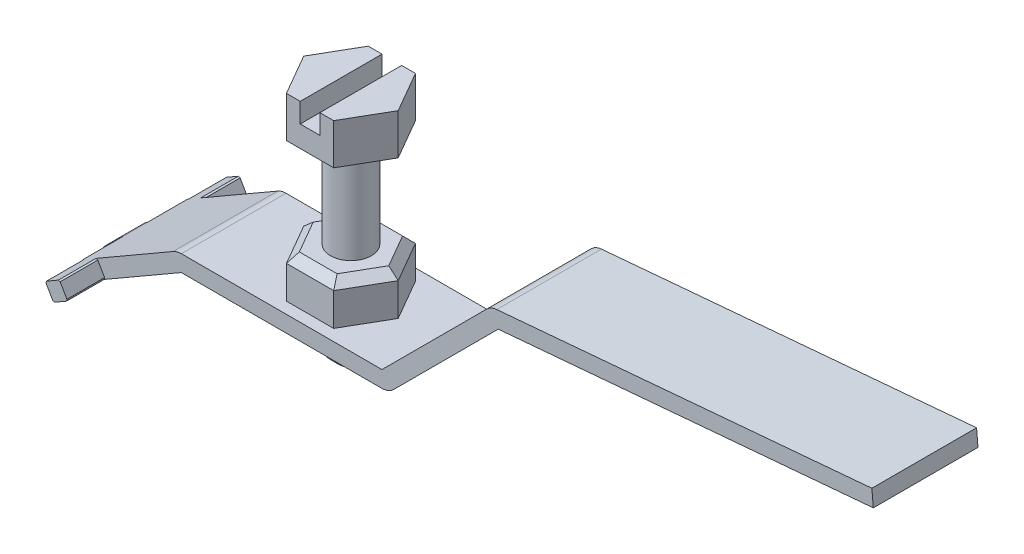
SolidWorks part; units mm, degrees
ref_plane "Plan de face" through (0, 0, 0) normal (0, 0, 1) x (1, 0, 0)
ref_plane "Plan de dessus" through (0, 0, 0) normal (0, 1, 0) x (1, 0, 0)
ref_plane "Plan de droite" through (0, 0, 0) normal (1, 0, 0) x (0, 0, -1)
sketch "Esquisse1" plane through (0, 0, 0) normal (0, 0, 1) x (1, 0, 0)
  line L0 (0, 0) -> (5.1962, 3) construction
  line L1 (5.1962, 3) -> (17.8038, 3) construction
  line L2 (17.8038, 3) -> (24.4737, 9.6698) construction
  line L3 (24.4737, 9.6698) -> (47.5847, 11.6918) construction
  line L4 (11.5, 3) -> (11.5, -11.7532) construction
  line L5 (0.25, -0.433) -> (5.3301, 2.5)
  line L6 (5.3301, 2.5) -> (17.5967, 2.5)
  line L7 (18.3038, 2.7929) -> (24.6985, 9.1876)
  line L8 (24.6985, 9.1876) -> (47.6283, 11.1937)
  line L9 (-0.25, 0.433) -> (4.8301, 3.366)
  line L10 (5.3301, 3.5) -> (17.5967, 3.5)
  line L11 (17.5967, 3.5) -> (23.9914, 9.8947)
  line L12 (24.6114, 10.1838) -> (47.5411, 12.1899)
  line L13 (47.5411, 12.1899) -> (47.6283, 11.1937)
  line L14 (17.5967, 3.5) -> (24.2488, 10.1521) construction
  line L15 (24.2488, 10.1521) -> (47.5411, 12.1899) construction
  line L16 (5.3301, 2.5) -> (18.011, 2.5) construction
  line L17 (18.011, 2.5) -> (24.6985, 9.1876) construction
  line L18 (-0.25, 0.433) -> (5.0622, 3.5) construction
  line L19 (5.0622, 3.5) -> (17.5967, 3.5) construction
  line L20 (-0.25, 0.433) -> (-0.683, 0.183)
  line L21 (-0.683, 0.183) -> (-0.183, -0.683)
  line L22 (-0.183, -0.683) -> (0.25, -0.433)
  circle A0 centre (0, 0) radius 49 construction
  arc A1 (23.9914, 9.8947) -> (24.6114, 10.1838) centre (24.6985, 9.1876) cw
  arc A2 (17.5967, 2.5) -> (18.3038, 2.7929) centre (17.5967, 3.5) ccw
  arc A3 (4.8301, 3.366) -> (5.3301, 3.5) centre (5.3301, 2.5) cw
  circle A4 centre (0, 0) radius 0.5 construction
  dimension "D1" = 98
  dimension "D10" = 1
  dimension "D2" = 7.5
  dimension "D3" = 135
  dimension "D4" = 150
  dimension "D5" = 140
  dimension "D6" = 11.5
  dimension "D7" = 3
  dimension "D8" = 0.5
  dimension "D9" = 0.5
extrude "Boss.-Extru.1" add sketch "Esquisse1" along normal mid plane 6.4
sketch "Esquisse2" plane through (0, 0, 0) normal (0, 0, 1) x (1, 0, 0)
  line L0 (-0.683, 0.183) -> (-0.183, -0.683) construction
  line L1 (4.8301, 3.366) -> (-0.683, 0.183) construction
  line L2 (-0.183, -0.683) -> (5.3301, 2.5) construction
  line L3 (-0.683, 0.183) -> (-0.183, -0.683)
  line L4 (0.183, 0.683) -> (-0.683, 0.183)
  line L5 (-0.183, -0.683) -> (0.683, -0.183)
  line L6 (0.183, 0.683) -> (0.683, -0.183)
extrude "Boss.-Extru.2" add sketch "Esquisse2" along normal mid plane 11
sketch "Esquisse3" plane through (0, 0, 5.5) normal (0, 0, 1) x (1, 0, 0)
  circle A0 centre (0, 0) radius 0.65
  dimension "D1" = 1.3
extrude "Enlèv. mat.-Extru.1" cut sketch "Esquisse3" against normal up to surface (2.3 mm away) flip side to cut
sketch "Esquisse4" plane through (0, 0, -5.5) normal (0, 0, -1) x (-1, 0, 0)
  circle A0 centre (0, 0) radius 0.65
  arc A1 (0.6407, 0.1097) -> (0.6097, 0.2253) centre (0, 0) ccw construction
extrude "Enlèv. mat.-Extru.2" cut sketch "Esquisse4" against normal up to surface (2.3 mm away) flip side to cut
sketch "Esquisse5" plane through (0, 0, 0) normal (0, 0, 1) x (1, 0, 0)
  line L0 (12.5, 9.2096) -> (12.5, -3.4631) construction
  dimension "D1" = 12.5
sketch "Esquisse6" plane through (0, 3.5, 0) normal (0, 1, 0) x (1, 0, 0)
  circle A0 centre (12.5, 0) radius 1.5
  dimension "D1" = 3
extrude "Enlèv. mat.-Extru.3" cut sketch "Esquisse6" against normal blind 11
sketch "Esquisse7" plane through (0, 3.5, 0) normal (0, 1, 0) x (1, 0, 0)
  line L1 (15.3868, 0) -> (13.9434, 2.5)
  line L2 (13.9434, 2.5) -> (11.0566, 2.5)
  line L3 (11.0566, 2.5) -> (9.6132, 0)
  line L4 (9.6132, 0) -> (11.0566, -2.5)
  line L5 (11.0566, -2.5) -> (13.9434, -2.5)
  line L6 (13.9434, -2.5) -> (15.3868, 0)
  circle A0 centre (12.5, 0) radius 2.5 construction
  circle A1 centre (12.5, 0) radius 1
  dimension "D2" = 2
  dimension "D1" = 5
extrude "Boss.-Extru.3" add sketch "Esquisse7" along normal blind 2.5 separate body
chamfer "Chanfrein1" distance 0.5 angle 45 6 edges at (10.3349, 6, -1.25) (12.5, 6, -2.5) (14.6651, 6, -1.25) (14.6651, 6, 1.25) (12.5, 6, 2.5) (10.3349, 6, 1.25)
sketch "Esquisse8" plane through (0, 6, 0) normal (0, 1, 0) x (1, 0, 0)
  circle A0 centre (12.5, 0) radius 1.25
  dimension "D1" = 2.5
extrude "Boss.-Extru.4" add sketch "Esquisse8" along normal blind 6 and the other way blind 6 separate body
chamfer "Chanfrein2" distance 0.5 angle 45 1 edges at (12.5, 0, 1.25)
sketch "Esquisse9" plane through (0, 12, 0) normal (0, 1, 0) x (1, 0, 0)
  line L1 (13.9434, 2.5) -> (11.0566, 2.5)
  line L2 (11.0566, 2.5) -> (9.6132, 0)
  line L3 (9.6132, 0) -> (11.0566, -2.5)
  line L4 (11.0566, -2.5) -> (13.9434, -2.5)
  line L5 (13.9434, -2.5) -> (15.3868, 0)
  line L6 (15.3868, 0) -> (13.9434, 2.5)
  circle A0 centre (12.5, 0) radius 2.5 construction
  dimension "D1" = 5
extrude "Boss.-Extru.5" add sketch "Esquisse9" along normal blind 2.5
sketch "Esquisse10" plane through (0, 0, 0) normal (0, 0, 1) x (1, 0, 0)
  line L0 (11.0566, 14.5) -> (13.9434, 14.5) construction
  line L1 (11.9, 14.5) -> (13.1, 14.5)
  line L2 (11.9, 14.5) -> (11.9, 13.3)
  line L3 (11.9, 13.3) -> (13.1, 13.3)
  line L4 (13.1, 13.3) -> (13.1, 14.5)
  line L6 (12.5, 9.2096) -> (12.5, 15.6383) construction
  dimension "D1" = 1.2
  dimension "D2" = 1.2
extrude "Enlèv. mat.-Extru.4" cut sketch "Esquisse10" against normal mid plane 10
sketch "Esquisse11" plane through (0, 0, 0) normal (0, 0, 1) x (1, 0, 0)
  line L0 (-0.183, -0.683) -> (-1.1036, -1.6036)
  line L1 (-0.8901, 0.0241) -> (-1.8107, -0.8964)
  line L2 (-0.683, 0.183) -> (-0.183, -0.683)
  line L3 (-0.1097, -0.6407) -> (0.6097, -0.2253) construction
  arc A0 (-1.8107, -0.8964) -> (-1.1036, -1.6036) centre (-1.4571, -1.25) ccw
  arc A1 (-0.683, 0.183) -> (-0.8901, 0.0241) centre (-0.183, -0.683) ccw
  dimension "D1" = 165
  dimension "D2" = 1.25
extrude "Boss.-Extru.6" add sketch "Esquisse11" along normal mid plane 1.5
